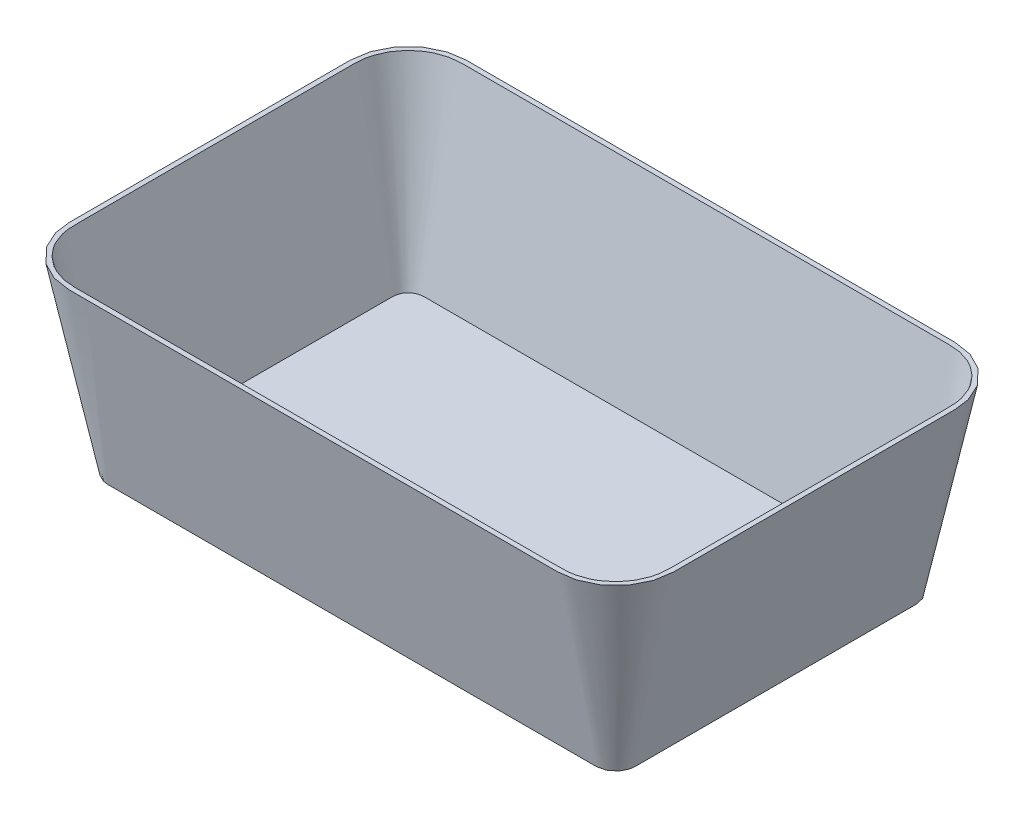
SolidWorks part; units mm, degrees
ref_plane "Front" through (0, 0, 0) normal (0, 0, 1) x (1, 0, 0)
ref_plane "Top" through (0, 0, 0) normal (0, 1, 0) x (1, 0, 0)
ref_plane "Right" through (0, 0, 0) normal (1, 0, 0) x (0, 0, -1)
sketch "Sketch1" plane through (0, 0, 0) normal (0, 1, 0) x (1, 0, 0)
  line L1 (160.02, -104.775) -> (-160.02, -104.775)
  line L2 (172.72, -92.075) -> (172.72, 92.075)
  line L3 (160.02, 104.775) -> (-160.02, 104.775)
  line L4 (-172.72, -92.075) -> (-172.72, 92.075)
  line L5 (172.72, -104.775) -> (-172.72, 104.775) construction
  line L6 (172.72, 104.775) -> (-172.72, -104.775) construction
  arc A0 (172.72, 92.075) -> (160.02, 104.775) centre (160.02, 92.075) ccw
  arc A1 (160.02, -104.775) -> (172.72, -92.075) centre (160.02, -92.075) ccw
  arc A2 (-160.02, -104.775) -> (-172.72, -92.075) centre (-160.02, -92.075) cw
  arc A3 (-160.02, 104.775) -> (-172.72, 92.075) centre (-160.02, 92.075) ccw
  point P0 (0, 0)
  dimension "D3" = 12.7
  dimension "D1" = 209.55
  dimension "D2" = 345.44
ref_plane "Plane1" through (0, 123.19, 0) normal (0, -1, 0) x (-1, 0, 0)
sketch "Sketch3" plane through (0, 123.19, 0) normal (0, -1, 0) x (-1, 0, 0)
  line L8 (-198.12, 92.075) -> (-198.12, -92.075)
  line L9 (160.02, 130.175) -> (-160.02, 130.175)
  line L10 (198.12, -92.075) -> (198.12, 92.075)
  line L11 (-160.02, -130.175) -> (160.02, -130.175)
  line L12 (-198.12, 92.075) -> (-198.12, -92.075)
  line L13 (160.02, 130.175) -> (-160.02, 130.175)
  line L14 (198.12, -92.075) -> (198.12, 92.075)
  line L15 (-160.02, -130.175) -> (160.02, -130.175)
  arc A8 (-160.02, 130.175) -> (-198.12, 92.075) centre (-160.02, 92.075) ccw
  arc A9 (198.12, 92.075) -> (160.02, 130.175) centre (160.02, 92.075) ccw
  arc A10 (160.02, -130.175) -> (198.12, -92.075) centre (160.02, -92.075) ccw
  arc A11 (-198.12, -92.075) -> (-160.02, -130.175) centre (-160.02, -92.075) ccw
  arc A12 (-160.02, 130.175) -> (-198.12, 92.075) centre (-160.02, 92.075) ccw
  arc A13 (198.12, 92.075) -> (160.02, 130.175) centre (160.02, 92.075) ccw
  arc A14 (160.02, -130.175) -> (198.12, -92.075) centre (160.02, -92.075) ccw
  arc A15 (-198.12, -92.075) -> (-160.02, -130.175) centre (-160.02, -92.075) ccw
  dimension "D1" = 25.4
loft "Loft1" add profiles "Sketch3", "Sketch1"
shell "Shell2" thickness 3.175
